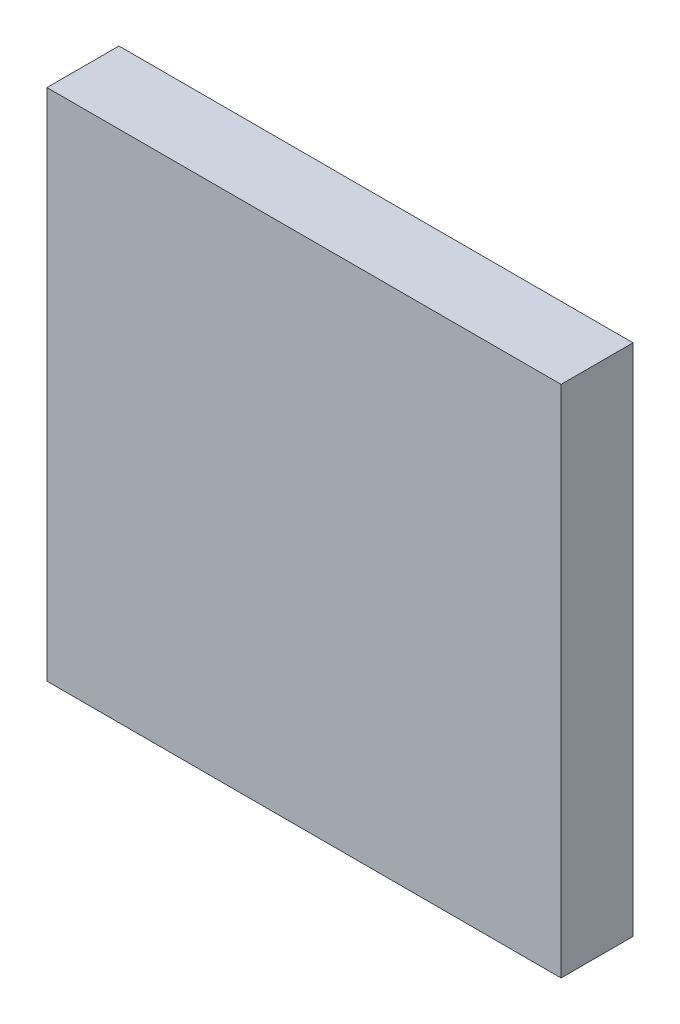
SolidWorks part; units mm, degrees
ref_plane "Front Plane" through (0, 0, 0) normal (0, 0, 1) x (1, 0, 0)
ref_plane "Top Plane" through (0, 0, 0) normal (0, 1, 0) x (1, 0, 0)
ref_plane "Right Plane" through (0, 0, 0) normal (1, 0, 0) x (0, 0, -1)
sketch "Sketch1" plane through (0, 0, 0) normal (0, 0, 1) x (1, 0, 0)
  line L1 (0, 0) -> (25, 0)
  line L2 (0, 0) -> (0, 25)
  line L3 (0, 25) -> (25, 25)
  line L4 (25, 0) -> (25, 25)
  dimension "D1" = 25
  dimension "D2" = 25
extrude "Extrude1" add sketch "Sketch1" along normal blind 3.5
